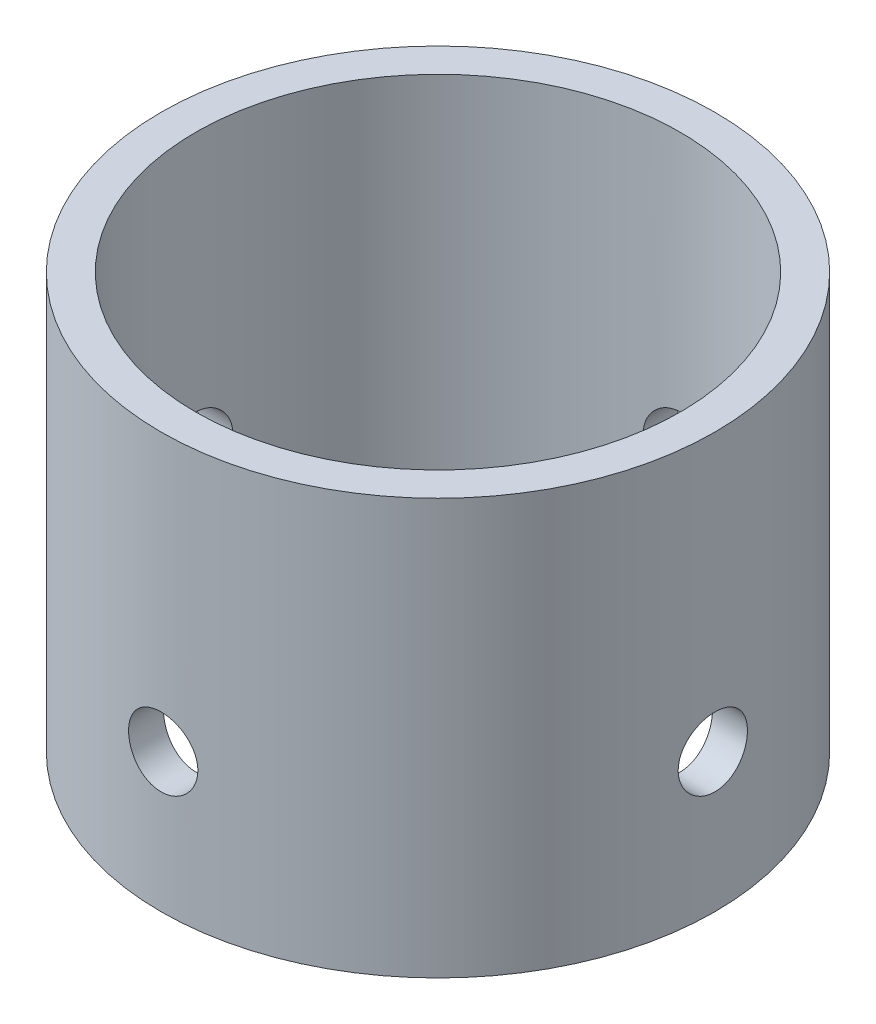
SolidWorks part; units mm, degrees
ref_plane "Front" through (0, 0, 0) normal (0, 0, 1) x (1, 0, 0)
ref_plane "Top" through (0, 0, 0) normal (0, 1, 0) x (1, 0, 0)
ref_plane "Right" through (0, 0, 0) normal (1, 0, 0) x (0, 0, -1)
sketch "Sketch1" plane through (0, 0, 0) normal (0, 1, 0) x (1, 0, 0)
  circle A0 centre (0, 0) radius 12.7
  circle A1 centre (0, 0) radius 11.1125
  dimension "D1" = 25.4
  dimension "D2" = 22.225
extrude "Boss-Extrude1" add sketch "Sketch1" along normal blind 19.05
ref_plane "Plane1" through (0, 0, -12.7) normal (0, 0, -1) x (-1, 0, 0)
sketch "Sketch2" plane through (0, 0, -12.7) normal (0, 0, -1) x (-1, 0, 0)
  circle A0 centre (0, 6.35) radius 1.5875
  dimension "D1" = 3.175
  dimension "D2" = 6.35
extrude "Cut-Extrude1" cut sketch "Sketch2" against normal through all contours A0
pattern_circular "CirPattern1" count 2 every 90 about axis through (0, 19.05, 0) along (0, -1, 0) of "Cut-Extrude1"
